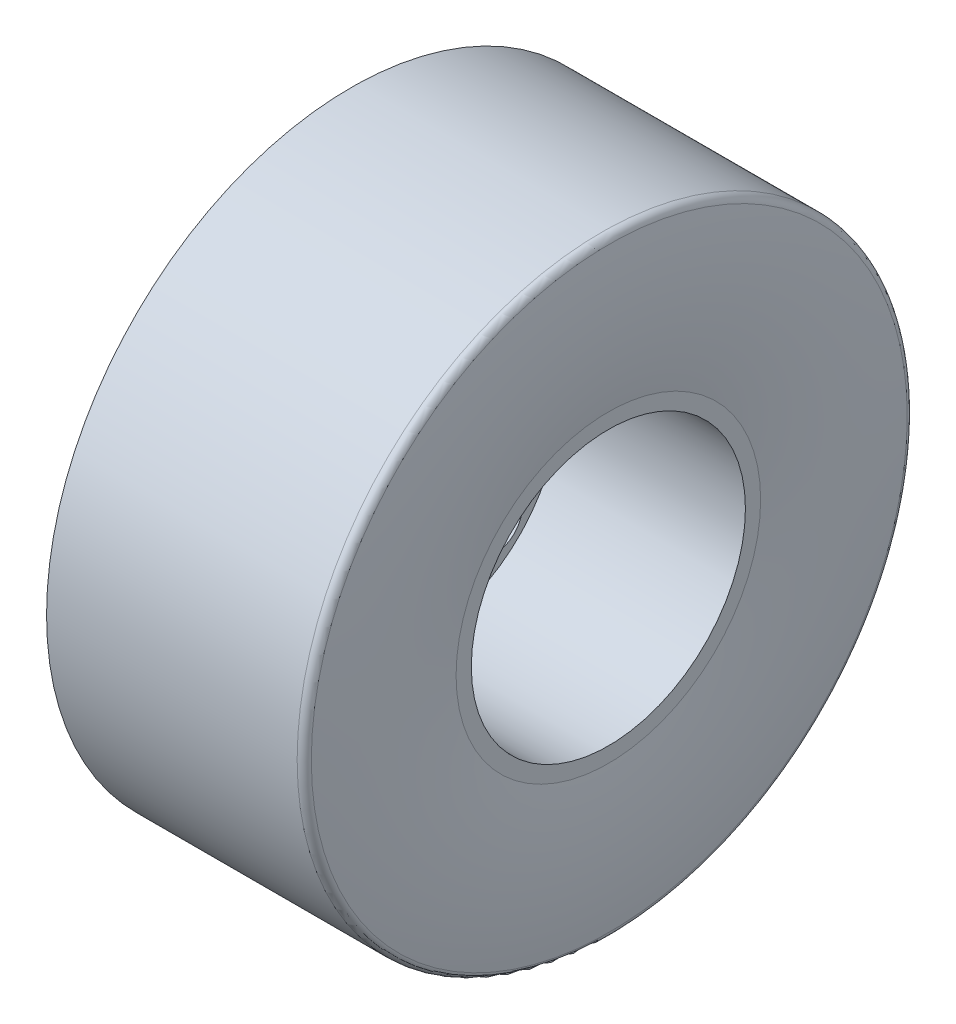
SolidWorks part; units mm, degrees
ref_plane "Front Plane" through (0, 0, 0) normal (0, 0, 1) x (1, 0, 0)
ref_plane "Top Plane" through (0, 0, 0) normal (0, 1, 0) x (1, 0, 0)
ref_plane "Right Plane" through (0, 0, 0) normal (1, 0, 0) x (0, 0, -1)
sketch "Sketch1" plane through (0, 0, 0) normal (0, 0, 1) x (1, 0, 0)
  line L0 (0, 0) -> (25.26, 0) construction
  line L1 (25.26, 40.3264) -> (25.26, -30.4784) construction
  line L2 (12.68, 9) -> (24.901, 9)
  line L3 (8.01, 20) -> (24.4653, 20)
  line L4 (12.68, 9) -> (12.68, 0)
  line L5 (8.01, 20) -> (8.01, 0)
  line L6 (8.01, 0) -> (12.68, 0)
  line L7 (24.901, 9) -> (24.901, 10)
  arc A0 (24.961, 19.5652) -> (24.901, 10) centre (-9.74, 15) cw
  arc A1 (24.4653, 20) -> (24.961, 19.5652) centre (24.4653, 19.5) cw
  point P15 (24.901, 20)
  dimension "D4" = 35
  dimension "D8" = 0.5
  dimension "D1" = 25.26
  dimension "D2" = 18
  dimension "D3" = 40
  dimension "D5" = 12.58
  dimension "D6" = 17.25
  dimension "D7" = 1
revolve "Revolve1" add sketch "Sketch1" angle 360 about L0
shell "Shell1" thickness 1.5875
sketch "Sketch2" plane through (11.0925, 0, 0) normal (-1, 0, 0) x (0, 0, 1)
  circle A0 centre (0, 0) radius 3.175
  dimension "D1" = 6.35
extrude "Extrude1" add sketch "Sketch2" along normal up to surface (11.0925 mm away)
sketch "Sketch3" plane through (12.68, 0, 0) normal (1, 0, 0) x (0, 0, -1)
  circle A0 centre (0, 0) radius 4.5
  dimension "D1" = 9
extrude "Extrude2" add sketch "Sketch3" along normal blind 2
sketch "Sketch4" plane through (14.68, 0, 0) normal (1, 0, 0) x (0, 0, -1)
  circle A0 centre (0, 0) radius 2.5
  dimension "D1" = 5
extrude "Extrude3" add sketch "Sketch4" along normal blind 2
sketch "Sketch5" plane through (12.68, 0, 0) normal (1, 0, 0) x (0, 0, -1)
  circle A0 centre (0, 6.75) radius 1.8
  circle A1 centre (0, 0) radius 6.75 construction
  dimension "D1" = 3.6
  dimension "D2" = 13.5
extrude "Cut-Extrude1" cut sketch "Sketch5" against normal through all
pattern_circular "CirPattern1" count 8 over 360 about axis through (0, 0, 0) along (1, 0, 0) of "Cut-Extrude1"
sketch "Sketch6" plane through (0, 0, 0) normal (-1, 0, 0) x (0, 0, 1)
  circle A0 centre (0, 0) radius 1.63
  dimension "D1" = 3.26
extrude "Cut-Extrude2" cut sketch "Sketch6" against normal offset from surface (15.0925 mm away) 1.5875
sketch "Sketch7" plane through (14.68, 0, 0) normal (1, 0, 0) x (0, 0, -1)
  circle A0 centre (0, 3.5) radius 0.5
  circle A1 centre (0, 0) radius 3.5 construction
  dimension "D1" = 1
  dimension "D2" = 7
extrude "Extrude4" add sketch "Sketch7" along normal blind 0.25
pattern_circular "CirPattern2" count 10 over 360 about axis through (0, 0, 0) along (1, 0, 0) of "Extrude4"
sketch "Sketch8" plane through (0, 0, 0) normal (0, 1, 0) x (1, 0, 0)
  line L0 (16.26, 17.2217) -> (16.26, 12.109)
  line L1 (8.01, 18.4125) -> (8.01, -18.4125) construction
  dimension "D1" = 8.25
rib "Rib1" sketch "Sketch8" sketch "Sketch8" thickness 1 extrusion direction parallel to sketch draft on no parameters "D1"=1
sketch "Sketch9" plane through (16.26, 0, 0) normal (-1, 0, 0) x (0, 0, 1)
  circle A0 centre (-14.5, 0) radius 1.125
  circle A1 centre (0, 0) radius 14.5 construction
  dimension "D1" = 2.25
  dimension "D2" = 29
extrude "Extrude5" add sketch "Sketch9" against normal up to next
pattern_circular "CirPattern3" count 6 over 360 about axis through (0, 0, 0) along (1, 0, 0) of "Rib1", "Extrude5"
